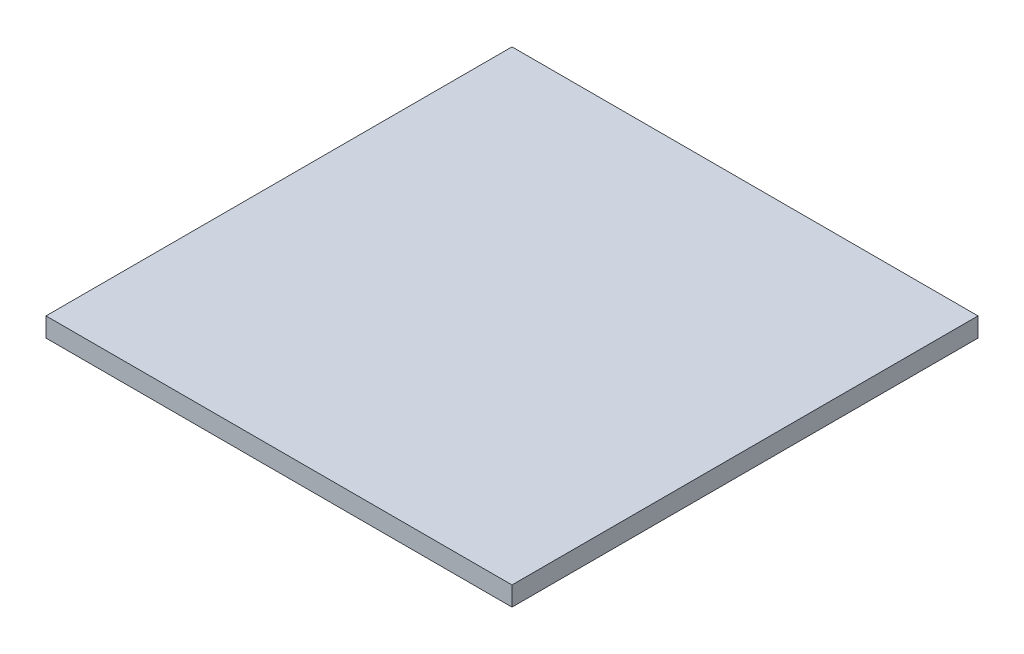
SolidWorks part; units mm, degrees
ref_plane "Front Plane" through (0, 0, 0) normal (0, 0, 1) x (1, 0, 0)
ref_plane "Top Plane" through (0, 0, 0) normal (0, 1, 0) x (1, 0, 0)
ref_plane "Right Plane" through (0, 0, 0) normal (1, 0, 0) x (0, 0, -1)
sketch "Sketch1" plane through (0, 0, 0) normal (0, 1, 0) x (1, 0, 0)
  line L1 (-15.125, -15.125) -> (15.125, -15.125)
  line L2 (-15.125, -15.125) -> (-15.125, 15.125)
  line L3 (-15.125, 15.125) -> (15.125, 15.125)
  line L4 (15.125, -15.125) -> (15.125, 15.125)
  line L5 (-15.125, -15.125) -> (15.125, 15.125) construction
  line L6 (-15.125, 15.125) -> (15.125, -15.125) construction
  point P0 (0, 0)
  dimension "D1" = 15.125
extrude "Boss-Extrude1" add sketch "Sketch1" along normal blind 1.25
